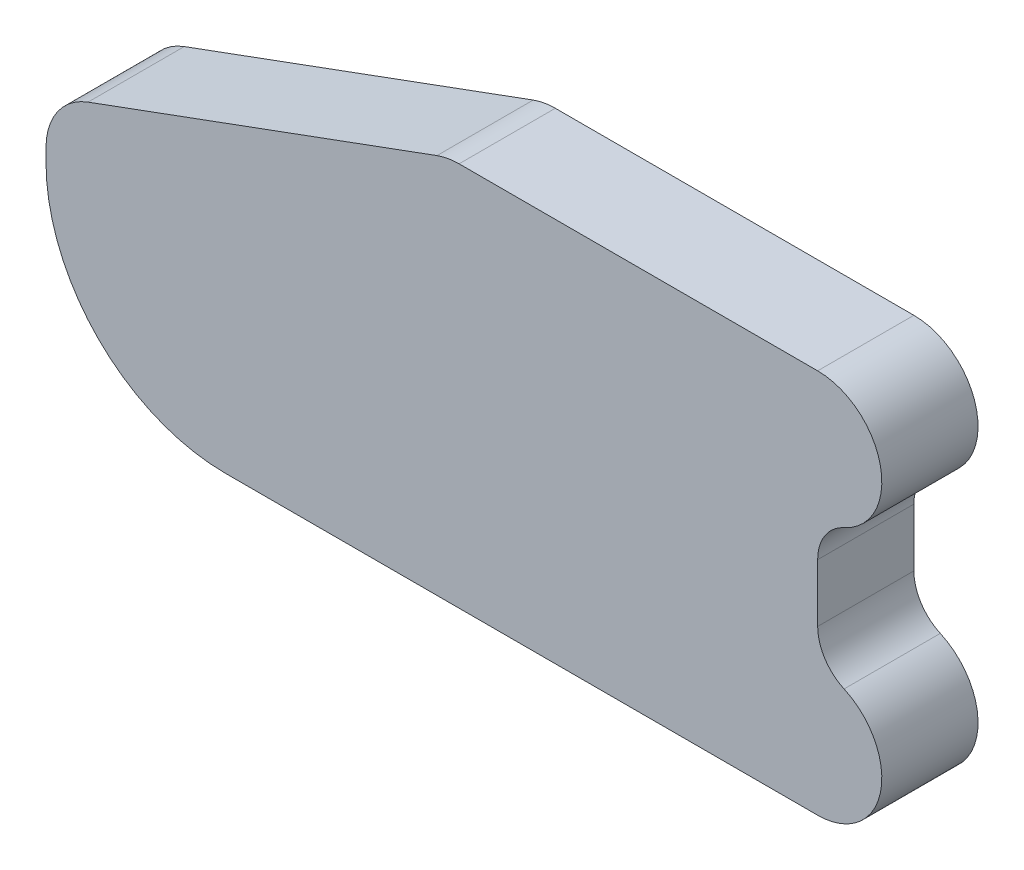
SolidWorks part; units mm, degrees
ref_plane "Face" through (0, 0, 0) normal (0, 0, 1) x (1, 0, 0)
ref_plane "Dessus" through (0, 0, 0) normal (0, 1, 0) x (1, 0, 0)
ref_plane "Droite" through (0, 0, 0) normal (1, 0, 0) x (0, 0, -1)
sketch "Esquisse1" plane through (0, 0, 0) normal (0, 0, 1) x (1, 0, 0)
  line L0 (-119.0477, 59.3869) -> (-173.4477, 39.4066)
  line L1 (-115.6, 60) -> (-59.7, 60)
  line L2 (-180, 30.0197) -> (-180, 28)
  line L3 (-152, 0) -> (-59.7, 0)
  line L5 (-49.7, 72.659) -> (-49.7, -11.3493) construction
  line L6 (-59.7, 34.5081) -> (-59.7, 25.4919)
  arc A0 (-152, 0) -> (-180, 28) centre (-152, 28) cw
  arc A1 (-59.7, 34.5081) -> (-55.5824, 40.8871) centre (-52.7, 34.5081) cw
  arc A2 (-173.4477, 39.4066) -> (-180, 30.0197) centre (-170, 30.0197) ccw
  arc A3 (-115.6, 60) -> (-119.0477, 59.3869) centre (-115.6, 50) ccw
  arc A4 (-55.5824, 19.1129) -> (-59.7, 25.4919) centre (-52.7, 25.4919) cw
  arc A6 (-55.5824, 40.8871) -> (-59.7, 60) centre (-59.7, 50) ccw
  arc A7 (-59.7, 0) -> (-55.5824, 19.1129) centre (-59.7, 10) ccw
  point P6 (-180, 0)
  point P13 (-180, 37)
  point P16 (-117.3783, 60)
  point P21 (0, 0)
  dimension "D5" = 28
  dimension "D6" = 20
  dimension "D9" = 10
  dimension "D12" = 20
  dimension "D13" = 20
  dimension "D8" = 7
  dimension "D1" = 60
  dimension "D2" = 37
  dimension "D3" = 152
  dimension "D7" = 65.9
  dimension "D10" = 102.3
extrude "Base-Extrusion" add sketch "Esquisse1" along normal blind 15
